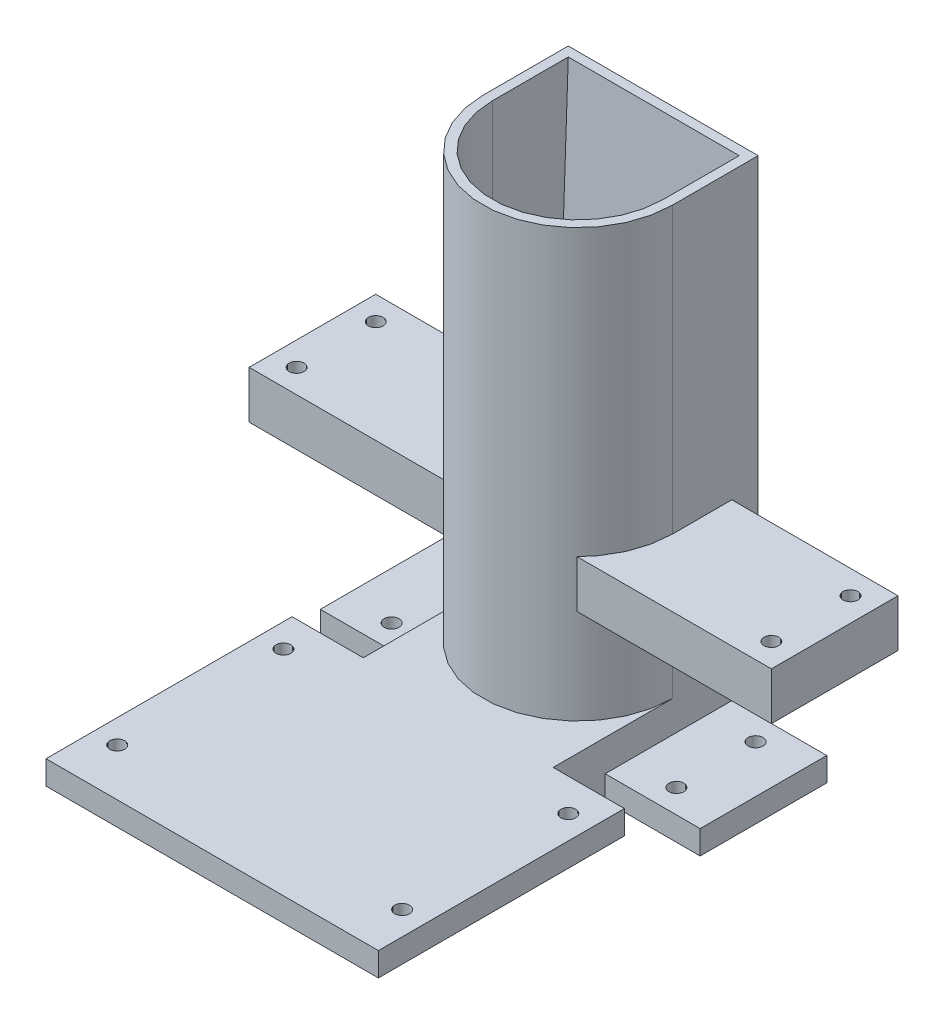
SolidWorks part; units mm, degrees
other "Markup1"
sketch "Sketch24" plane through (-51.5286, 177.8, 76.2) normal (-0.8191, 0.3143, 0.4799) x (-0.3836, -0.9221, -0.0508)
ref_plane "Front Plane" through (0, 0, 0) normal (0, 0, 1) x (1, 0, 0)
ref_plane "Top Plane" through (0, 0, 0) normal (0, 1, 0) x (1, 0, 0)
ref_plane "Right Plane" through (0, 0, 0) normal (1, 0, 0) x (0, 0, -1)
sketch "Sketch1" plane through (0, 0, 0) normal (0, 0, 1) x (1, 0, 0)
  line L0 (-25.4, -80.1) -> (-10, -80.1) construction
  line L2 (-25.4, -38.4714) -> (-25.4, -113.05)
  line L3 (-25.4, -113.05) -> (25.4, -113.05)
  line L4 (25.4, -38.4714) -> (25.4, -113.05)
  line L5 (-10, -59.85) -> (10, -59.85)
  line L6 (-10, -59.85) -> (-10, -100.35)
  line L7 (-10, -100.35) -> (10, -100.35)
  line L8 (10, -59.85) -> (10, -100.35)
  line L9 (10, -80.1) -> (25.4, -80.1) construction
  line L10 (0, -69.85) -> (-10, -69.85) construction
  line L11 (0, -69.85) -> (10, -69.85) construction
  arc A0 (25.4, -38.4714) -> (-25.4, -38.4714) centre (0, 0) ccw
  circle A1 centre (0, 0) radius 38.1
  point P13 (0, -69.85)
  point P14 (-10, -80.1)
  dimension "D1" = 8
  dimension "D2" = 76.2
  dimension "D3" = 69.85
  dimension "D4" = 10
  dimension "D6" = 40.5
  dimension "D8" = 12.7
  dimension "D5" = 50.8
  dimension "D7" = 20
extrude "Boss-Extrude1" add sketch "Sketch1" along normal blind 76.2
sketch "Sketch2" plane through (0, 0, 0) normal (1, 0, 0) x (0, 0, -1)
  line L0 (-71.8569, -1.8031) -> (-73.66, 0)
  line L1 (-73.66, 0) -> (-71.8569, 1.8031)
  line L3 (-76.2, 38.1) -> (-76.2, -38.1) construction
  arc A0 (-71.8569, -1.8031) -> (-71.8569, 1.8031) centre (-70.0538, 0) ccw
  dimension "D1" = 5.1
  dimension "D2" = 90
  dimension "D3" = 2.54
extrude "Cut-Extrude1" cut sketch "Sketch2" against normal through all both and the other way through all contours A0 L1 L0
ref_plane "Plane1" through (46.1, 0, 0) normal (1, 0, 0) x (0, 0, -1)
sketch "Sketch3" plane through (46.1, 0, 0) normal (1, 0, 0) x (0, 0, -1)
  line L0 (-71.8569, -1.8031) -> (-73.66, 0) construction
  line L1 (-73.66, 0) -> (-71.8569, 1.8031) construction
  line L2 (-71.8569, -1.8031) -> (-73.66, 0)
  line L3 (-73.66, 0) -> (-71.8569, 1.8031)
  line L4 (-74.2257, 0) -> (-72.1397, 2.086)
  line L5 (-72.1397, -2.086) -> (-74.2257, 0)
  arc A0 (-71.8569, -1.8031) -> (-71.8569, 1.8031) centre (-70.0538, 0) ccw construction
  arc A1 (-71.8569, -1.8031) -> (-71.8569, 1.8031) centre (-70.0538, 0) ccw
  arc A2 (-72.1397, -2.086) -> (-72.1397, 2.086) centre (-70.0538, 0) ccw
  dimension "D1" = 0.4
extrude "Cut-Extrude2" cut sketch "Sketch3" against normal blind 1
mirror "Mirror1" about plane through (0, 0, 0) normal (1, 0, 0) of "Cut-Extrude2"
sketch "Sketch4" plane through (0, 0, 76.2) normal (0, 0, 1) x (1, 0, 0)
  line L0 (-25.4, -113.05) -> (25.4, -113.05) construction
  line L2 (-25.4, -38.4714) -> (-25.4, -113.05)
  line L3 (-25.4, -113.05) -> (25.4, -113.05)
  line L4 (25.4, -38.4714) -> (25.4, -113.05)
  arc A0 (-25.4, -38.4714) -> (25.4, -38.4714) centre (0, 0) ccw
  arc A1 (25.4, -38.4714) -> (-25.4, -38.4714) centre (0, 0) ccw construction
extrude "Cut-Extrude3" cut sketch "Sketch4" against normal offset from surface 13.9 and the other way through all
ref_plane "Plane2" through (0, 46.1, 0) normal (0, 1, 0) x (1, 0, 0)
ref_plane "Plane3" through (0, 173.1, 0) normal (0, 1, 0) x (1, 0, 0)
sketch "Sketch9" plane through (0, 173.1, 0) normal (0, 1, 0) x (1, 0, 0)
  line L0 (-25.4, 53.34) -> (25.4, 53.34)
  line L1 (25.4, 53.34) -> (25.4, 27.94)
  line L2 (25.4, 27.94) -> (-25.4, 27.94) construction
  line L3 (-25.4, 27.94) -> (-25.4, 53.34)
  line L4 (0, 0) -> (0, 27.94) construction
  line L5 (-46.1, -76.2) -> (46.1, -76.2) construction
  arc A0 (-25.4, 27.94) -> (25.4, 27.94) centre (0, 27.94) ccw
  point P8 (0, 27.94)
  dimension "D2" = 25.4
  dimension "D1" = 50.8
  dimension "D3" = 129.54
sketch3d "3DSketch2"
  line L0 (0, 173.1, -27.94) -> (0, 74.1819, -27.94)
  line L1 (25.4, 173.1, -27.94) -> (-25.4, 173.1, -27.94) construction
  line L2 (0, 53.7227, -23.638) -> (0, 0, 0)
  arc A0 (0, 74.1819, -27.94) -> (0, 53.7227, -23.638) centre (0, 74.1819, 22.86) ccw
  point P8 (0, 0, -27.94)
  point P13 (0, 63.5, -27.94)
  point P14 (-50.8, 74.1819, 22.86)
  dimension "D1" = 63.5
  dimension "D2" = 50.8
extrude "Boss-Extrude3" add sketch "Sketch9" against normal up to surface (127 mm away) separate body contours L0 L1 A0 L3
sketch "Sketch18" plane through (0, 46.1, 0) normal (0, -1, 0) x (1, 0, 0)
  line L0 (25.4, -53.34) -> (-25.4, -53.34) construction
  line L1 (25.4, -27.94) -> (25.4, -53.34) construction
  line L2 (-25.4, -53.34) -> (-25.4, -27.94) construction
  line L3 (25.4, -53.34) -> (-25.4, -53.34)
  line L4 (25.4, -27.94) -> (25.4, -53.34)
  line L5 (-25.4, -53.34) -> (-25.4, -27.94)
  arc A0 (25.4, -27.94) -> (-25.4, -27.94) centre (0, -27.94) ccw construction
  arc A1 (25.4, -27.94) -> (-25.4, -27.94) centre (0, -27.94) ccw
sketch "Sketch19" plane through (0, 0, 0) normal (1, 0, 0) x (0, 0, -1)
  line L0 (0, -113.05) -> (0, -38.4714) construction
  line L1 (53.34, 46.1) -> (53.34, 173.1) construction
  line L2 (53.34, 46.1) -> (27.94, 46.1) construction
  arc A0 (0, -49.962) -> (53.34, 46.1) centre (-59.8308, 46.1) ccw
sketch "Sketch20" plane through (0, 0, 0) normal (0, 0, -1) x (-1, 0, 0)
  circle A0 centre (0, 0) radius 46.1
  arc A1 (25.4, -38.4714) -> (-25.4, -38.4714) centre (0, 0) ccw construction
sweep "Sweep2" add profiles "Sketch20" path "Sketch19"
sketch "Sketch21" plane through (0, 173.1, 0) normal (0, 1, 0) x (1, 0, 0)
  line L0 (-25.4, 53.34) -> (-25.4, 27.94)
  line L1 (-25.4, 27.94) -> (25.4, 27.94) construction
  line L2 (25.4, 27.94) -> (25.4, 53.34)
  line L3 (25.4, 53.34) -> (-25.4, 53.34)
  arc A0 (-25.4, 27.94) -> (25.4, 27.94) centre (0, 27.94) ccw
  circle A1 centre (0, 27.94) radius 101.6
  dimension "D1" = 203.2
extrude "Cut-Extrude4" cut sketch "Sketch21" against normal offset from surface (114.3 mm away) 12.7
sketch "Sketch22" plane through (0, 0, 76.2) normal (0, 0, 1) x (1, 0, 0)
  line L0 (-25.4, 38.4714) -> (-25.4, 173.1)
  line L1 (-25.4, 58.8) -> (-25.4, 173.1) construction
  line L2 (25.4, 38.4714) -> (25.4, 173.1)
  line L3 (25.4, 58.8) -> (25.4, 173.1) construction
  line L4 (25.4, 173.1) -> (-25.4, 173.1)
  line L5 (41.91, 173.1) -> (-41.91, 173.1) construction
  line L6 (25.4, -38.4714) -> (25.4, -113.05)
  line L7 (25.4, -113.05) -> (-25.4, -113.05)
  line L8 (-25.4, -113.05) -> (-25.4, -38.4714)
  line L9 (-25.4, -113.05) -> (-25.4, -38.4714) construction
  line L10 (25.4, -38.4714) -> (25.4, -113.05) construction
  line L11 (25.4, -113.05) -> (-25.4, -113.05) construction
  arc A0 (-25.4, 38.4714) -> (-25.4, -38.4714) centre (0, 0) ccw
  circle A1 centre (0, 0) radius 46.1 construction
  arc A2 (25.4, -38.4714) -> (25.4, 38.4714) centre (0, 0) ccw
extrude "Cut-Extrude6" cut sketch "Sketch22" against normal through all flip side to cut
fillet "Fillet1" radius 12.7 1 edges at (0, 46.1, -53.34)
shell "Shell8" thickness 2.54
ref_plane "Plane4" through (0, 0, -9) normal (0, 0, -1) x (-1, 0, 0)
sketch "Sketch29" plane through (0, -113.05, 0) normal (0, -1, 0) x (-1, 0, 0)
  line L1 (44.45, 10) -> (-44.45, 10)
  line L2 (44.45, 10) -> (44.45, 16.35)
  line L3 (44.45, 16.35) -> (-44.45, 16.35)
  line L4 (-44.45, 10) -> (-44.45, 16.35)
  line L5 (0, 23.638) -> (0, 0) construction
  line L6 (56.089, 9) -> (-56.089, 9) construction
  dimension "D1" = 6.35
  dimension "D2" = 44.45
  dimension "D3" = 44.45
  dimension "D4" = 1
ref_plane "Plane5" through (0, 0, 63.5) normal (0, 0, 1) x (1, 0, 0)
extrude "Boss-Extrude4" add sketch "Sketch29" against normal up to surface (113.2699 mm away) contours L3 L4 L1 L2
sketch "Sketch44" plane through (0, 0, -16.35) normal (0, 0, -1) x (-1, 0, 0)
  circle A0 centre (0, -69.85) radius 10.9
  point P0 (0, -69.85)
  dimension "D1" = 21.8
extrude "Cut-Extrude20" cut sketch "Sketch44" against normal up to surface (6.35 mm away)
sketch "Sketch45" plane through (0, 58.8, 0) normal (0, 1, 0) x (1, 0, 0)
  line L3 (-25.4, -5.3128) -> (25.4, -5.3128)
  line L4 (25.4, 1.0372) -> (25.4, -5.3128)
  line L5 (-25.4, 27.94) -> (-25.4, -0.8678) construction
  line L6 (-25.4, 1.0372) -> (25.4, 1.0372)
  line L7 (25.4, -0.8678) -> (25.4, 27.94) construction
  line L8 (-25.4, 1.0372) -> (-25.4, -5.3128)
  dimension "D1" = 1.905
  dimension "D2" = 6.35
extrude "Boss-Extrude7" add sketch "Sketch45" against normal offset from surface (18.8155 mm away) 1.27
sketch "Sketch46" plane through (0, 58.8, 0) normal (0, 1, 0) x (1, 0, 0)
  line L0 (-44.45, -4.0428) -> (-46.1, -4.0428) construction
  line L1 (-44.45, -4.0428) -> (44.45, -4.0428)
  line L2 (-44.45, -4.0428) -> (-44.45, -69.85)
  line L3 (-44.45, -69.85) -> (44.45, -69.85)
  line L4 (44.45, -4.0428) -> (44.45, -69.85)
  line L5 (-46.1, 0) -> (-46.1, -67.1038) construction
  line L6 (-46.1, -76.2) -> (46.1, -76.2) construction
  line L7 (-25.4, -5.3128) -> (25.4, -5.3128) construction
  line L9 (44.45, -4.0428) -> (46.1, -4.0428) construction
  line L11 (46.1, -80.4214) -> (46.1, 80.4214) construction
  dimension "D1" = 6.35
  dimension "D2" = 1.27
  dimension "D3" = 88.9
extrude "Boss-Extrude10" add sketch "Sketch46" against normal offset from surface (6.35 mm away) 6.35
sketch "Sketch43" plane through (0, 0, -10) normal (0, 0, 1) x (1, 0, 0)
  circle A0 centre (0, 0) radius 48.64
  circle A1 centre (0, 0) radius 46.1 construction
  dimension "D1" = 2.54
extrude "Cut-Extrude19" cut sketch "Sketch43" along normal blind 10
sketch "Sketch49" plane through (25.4, 0, 0) normal (1, 0, 0) x (0, 0, -1)
  line L0 (0, 46.1) -> (0, -38.4714) construction
  line L1 (0, 44.0212) -> (10, 44.0212)
  line L2 (0, 44.0212) -> (0, 41.2272)
  line L3 (0, 41.2272) -> (10, 41.2272)
  line L4 (10, 44.0212) -> (10, 41.2272)
  line L5 (10, 38.4714) -> (10, 41.4812) construction
  line L6 (10, 41.4812) -> (0, 41.4812) construction
  dimension "D1" = 0.254
  dimension "D2" = 2.54
extrude "Cut-Extrude21" cut sketch "Sketch49" against normal through all both and the other way through all
sketch "Sketch50" plane through (0, 0, 13.9) normal (0, 0, 1) x (1, 0, 0)
  line L0 (10, -59.85) -> (10, -100.35) construction
  line L1 (-5, -56.1) -> (-5, -59.85) construction
  line L2 (-10, -59.85) -> (10, -59.85) construction
  line L3 (-5, -104.1) -> (-5, -100.35) construction
  line L4 (-10, -100.35) -> (10, -100.35) construction
  circle A0 centre (5, -56.1) radius 2
  circle A1 centre (-5, -56.1) radius 2
  circle A2 centre (5, -104.1) radius 2
  circle A3 centre (-5, -104.1) radius 2
  dimension "D1" = 4
  dimension "D2" = 5
  dimension "D3" = 10
  dimension "D4" = 48
extrude "Cut-Extrude22" cut sketch "Sketch50" against normal offset from surface 2.54 and the other way through all
sketch "Sketch51" plane through (-25.4, 0, 0) normal (-1, 0, 0) x (0, 0, 1)
  line L0 (-53.34, 173.1) -> (-48.26, 173.1)
  line L1 (-48.26, 173.1) -> (-43.8251, 46.1)
  line L2 (-43.8251, 46.1) -> (-53.34, 46.1)
  line L3 (-53.34, 173.1) -> (-53.34, 46.1)
  line L4 (-53.34, 46.1) -> (-27.94, 46.1) construction
  dimension "D1" = 2
  dimension "D2" = 5.08
extrude "Boss-Extrude14" add sketch "Sketch51" against normal up to surface (50.8 mm away)
sketch "Sketch52" plane through (0, 0, -16.35) normal (0, 0, -1) x (-1, 0, 0)
  line L0 (44.45, -113.05) -> (-44.45, -113.05) construction
  line L1 (-44.45, -100.35) -> (44.45, -100.35)
  line L2 (-44.45, -100.35) -> (-44.45, -36.85)
  line L3 (-44.45, -36.85) -> (44.45, -36.85)
  line L4 (44.45, -100.35) -> (44.45, -36.85)
  line L5 (44.45, 11.7808) -> (44.45, -113.05) construction
  circle A0 centre (0, -69.85) radius 10.9
  circle A1 centre (0, -69.85) radius 10.9 construction
  dimension "D2" = 12.7
  dimension "D1" = 63.5
extrude "Boss-Extrude15" add sketch "Sketch52" along normal offset from surface (56.04 mm away) 19.05
sketch "Sketch54" plane through (0, 0, -10) normal (0, 0, 1) x (1, 0, 0)
  line L0 (44.45, 0.2199) -> (44.45, -113.05) construction
  line L1 (-44.45, -113.05) -> (44.45, -113.05)
  line L2 (-44.45, -113.05) -> (-44.45, -102.5765)
  line L3 (-44.45, -102.5765) -> (44.45, -102.5765)
  line L4 (44.45, -113.05) -> (44.45, -102.5765)
  line L5 (-10, -100.35) -> (10, -100.35) construction
  dimension "D1" = 2.2265
extrude "Boss-Extrude20" add sketch "Sketch54" along normal blind 10.16
sketch "Sketch55" plane through (-25.4, 0, 0) normal (-1, 0, 0) x (0, 0, 1)
  line L1 (-53.34, 173.1) -> (-50.8, 173.1)
  line L2 (-53.34, 173.1) -> (-53.34, 20.7)
  line L3 (-53.34, 20.7) -> (-50.8, 20.7)
  line L4 (-50.8, 173.1) -> (-50.8, 20.7)
  line L5 (-27.94, 173.1) -> (-53.34, 173.1) construction
  dimension "D1" = 2.54
  dimension "D2" = 152.4
extrude "Cut-Extrude23" cut sketch "Sketch55" against normal through all both and the other way through all
sketch "Sketch57" plane through (0, 0, 76.2) normal (0, 0, 1) x (1, 0, 0)
  circle A0 centre (0, 0) radius 46.1
extrude "Cut-Extrude24" cut sketch "Sketch57" against normal up to surface and the other way through all
sketch "Sketch58" plane through (25.4, 0, 0) normal (1, 0, 0) x (0, 0, -1)
  line L0 (-13.9, -113.05) -> (0, -113.05) construction
  line L1 (0, -113.05) -> (-13.9, -113.05)
  line L2 (0, -113.05) -> (0, -38.4714)
  line L3 (0, -38.4714) -> (-13.9, -38.4714)
  line L4 (-13.9, -113.05) -> (-13.9, -38.4714)
  line L5 (0, -113.05) -> (0, -38.4714) construction
extrude "Cut-Extrude25" cut sketch "Sketch58" against normal through all both and the other way through all
sketch "Sketch59" plane through (0, 0, 0) normal (0, 0, 1) x (1, 0, 0)
  line L0 (-19.05, -107.97) -> (-44.45, -107.97) construction
  line L1 (-44.45, -102.5765) -> (-44.45, -113.05) construction
  line L2 (19.05, -107.97) -> (44.45, -107.97) construction
  line L3 (44.45, -102.5765) -> (44.45, -113.05) construction
  line L4 (-44.45, -113.05) -> (44.45, -113.05) construction
  circle A0 centre (-19.05, -107.97) radius 2
  circle A1 centre (19.05, -107.97) radius 2
  dimension "D1" = 5.08
  dimension "D2" = 4
  dimension "D3" = 38.1
extrude "Cut-Extrude26" cut sketch "Sketch59" against normal up to surface (16.35 mm away)
sketch "Sketch60" plane through (0, 58.8, 0) normal (0, 1, 0) x (1, 0, 0)
  line L0 (-50.71, -63.5) -> (50.71, -63.5) construction
  line L1 (-44.45, -4.0428) -> (-44.45, -69.85) construction
  circle A0 centre (38.1, -12.7) radius 2
  circle A1 centre (38.1, -57.15) radius 2
  circle A2 centre (-38.1, -57.15) radius 2
  circle A3 centre (-38.1, -12.7) radius 2
  dimension "D1" = 76.2
  dimension "D3" = 4
  dimension "D2" = 44.45
  dimension "D4" = 6.35
  dimension "D5" = 6.35
extrude "Cut-Extrude27" cut sketch "Sketch60" against normal up to surface (6.35 mm away)
sketch "Sketch61" plane through (25.4, 0, 0) normal (1, 0, 0) x (0, 0, -1)
  line L0 (10, 44.0212) -> (59.4111, 44.0212)
  line L1 (59.4111, 44.0212) -> (90.975, -120.058)
  line L2 (90.975, -120.058) -> (-34.9608, -120.058)
  line L3 (-34.9608, -120.058) -> (10, 44.0212)
extrude "Cut-Extrude28" cut sketch "Sketch61" against normal through all both and the other way through all
sketch "Sketch62" plane through (0, 44.0212, 0) normal (0, -1, 0) x (1, 0, 0)
  line L0 (25.4, 0) -> (25.4, -43.7439) construction
  line L1 (25.4, -43.7439) -> (50.8, -43.7439)
  line L2 (25.4, -43.7439) -> (25.4, -9.8773)
  line L3 (25.4, -9.8773) -> (50.8, -9.8773)
  line L4 (50.8, -43.7439) -> (50.8, -9.8773)
  line L5 (-25.4, -43.7439) -> (-25.4, 0) construction
  line L6 (-25.4, -43.7439) -> (-50.8, -43.7439)
  line L7 (-25.4, -43.7439) -> (-25.4, -9.8773)
  line L8 (-25.4, -9.8773) -> (-50.8, -9.8773)
  line L9 (-50.8, -43.7439) -> (-50.8, -9.8773)
  dimension "D1" = 25.4
  dimension "D2" = 33.8667
extrude "Boss-Extrude21" add sketch "Sketch62" against normal blind 6.35
sketch "Sketch63" plane through (0, 44.0212, 0) normal (0, -1, 0) x (-1, 0, 0)
  line L0 (50.8, 9.8773) -> (50.8, 43.7439) construction
  line L1 (50.8, 43.7439) -> (25.4, 43.7439) construction
  line L2 (25.4, 9.8773) -> (50.8, 9.8773) construction
  line L3 (-50.8, 43.7439) -> (-50.8, 9.8773) construction
  circle A0 centre (38.1, 37.3939) radius 2
  circle A1 centre (38.1, 16.2273) radius 2
  circle A2 centre (-38.1, 16.2273) radius 2
  circle A3 centre (-38.1, 37.3939) radius 2
  dimension "D1" = 4
  dimension "D4" = 6.35
  dimension "D2" = 12.7
  dimension "D3" = 6.35
  dimension "D5" = 12.7
extrude "Cut-Extrude29" cut sketch "Sketch63" against normal through all both and the other way through all
ref_plane "Plane6" through (0, 96.9, 0) normal (0, 1, 0) x (1, 0, 0)
sketch "Sketch64" plane through (0, 96.9, 0) normal (0, 1, 0) x (1, 0, 0)
  line L7 (-50.8, 9.8773) -> (-50.8, 43.7439) construction
  line L8 (-69.85, 9.8773) -> (-17.8577, 9.8773)
  line L9 (-69.85, 9.8773) -> (-69.85, 43.7439)
  line L10 (-69.85, 43.7439) -> (-25.4, 43.7439)
  line L11 (69.85, 9.8773) -> (69.85, 43.7439)
  line L12 (50.8, 43.7439) -> (50.8, 9.8773) construction
  line L13 (-25.4, 9.8773) -> (-50.8, 9.8773) construction
  line L14 (-50.8, 43.7439) -> (-25.4, 43.7439) construction
  line L15 (-25.4, 27.94) -> (-25.4, 50.8) construction
  line L16 (-25.4, 27.94) -> (-25.4, 43.7439)
  line L17 (25.4, 9.8773) -> (25.4, 43.7439) construction
  line L18 (25.4, 27.94) -> (25.4, 43.7439)
  line L19 (25.4, 43.7439) -> (69.85, 43.7439)
  line L20 (17.8577, 9.8773) -> (69.85, 9.8773)
  arc A4 (-25.4, 27.94) -> (25.4, 27.94) centre (0, 27.94) ccw construction
  arc A5 (-25.4, 27.94) -> (-17.8577, 9.8773) centre (0, 27.94) ccw
  arc A6 (17.8577, 9.8773) -> (25.4, 27.94) centre (0, 27.94) ccw
  circle A7 centre (-63.5, 37.3939) radius 1.9844
  circle A8 centre (-63.5, 16.2273) radius 1.9844
  circle A9 centre (63.5, 16.2273) radius 1.9844
  circle A10 centre (63.5, 37.3939) radius 1.9844
  point P29 (0, 0)
  point P30 (0, 0)
  point P31 (0, 0)
  point P32 (0, 0)
  dimension "D2" = 19.05
  dimension "D3" = 3.9688
  dimension "D1" = 19.05
  dimension "D4" = 6.35
  dimension "D5" = 6.35
  dimension "D6" = 6.35
  dimension "D7" = 6.35
extrude "Boss-Extrude22" add sketch "Sketch64" against normal blind 12.7
